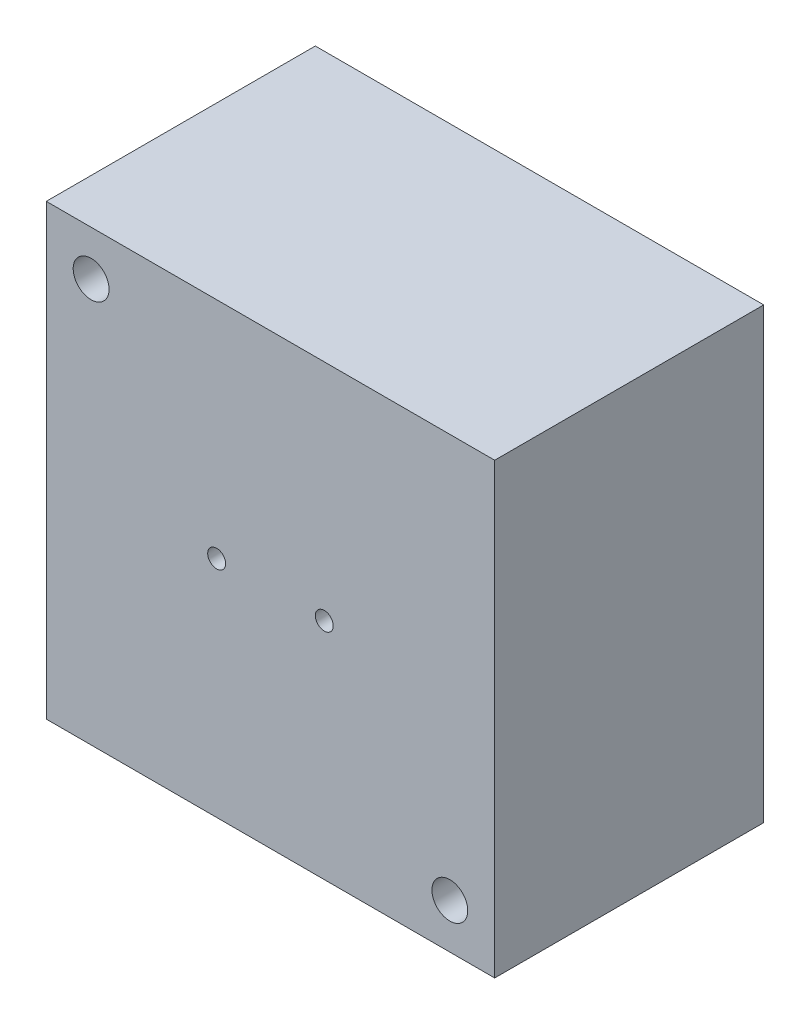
SolidWorks part; units mm, degrees
ref_plane "Front Plane" through (0, 0, 0) normal (0, 0, 1) x (1, 0, 0)
ref_plane "Top Plane" through (0, 0, 0) normal (0, 1, 0) x (1, 0, 0)
ref_plane "Right Plane" through (0, 0, 0) normal (1, 0, 0) x (0, 0, -1)
sketch "Sketch1" plane through (0, 0, 0) normal (0, 0, 1) x (1, 0, 0)
  line L1 (0, 0) -> (50, 0)
  line L2 (0, 0) -> (0, 50)
  line L3 (0, 50) -> (50, 50)
  line L4 (50, 0) -> (50, 50)
  dimension "D1" = 50
  dimension "D2" = 50
extrude "Boss-Extrude1" add sketch "Sketch1" along normal blind 30
other "Cavity1"
other "supportRod<1>@linear weight stage1"
other "supportRod<2>@linear weight stage1"
other "Cavity2"
other "B18.6.7M - M2 x 0.4 x 20 Indented HHMS --20C<1>@linear weight stage1"
other "B18.6.7M - M2 x 0.4 x 20 Indented HHMS --20C<2>@linear weight stage1"
